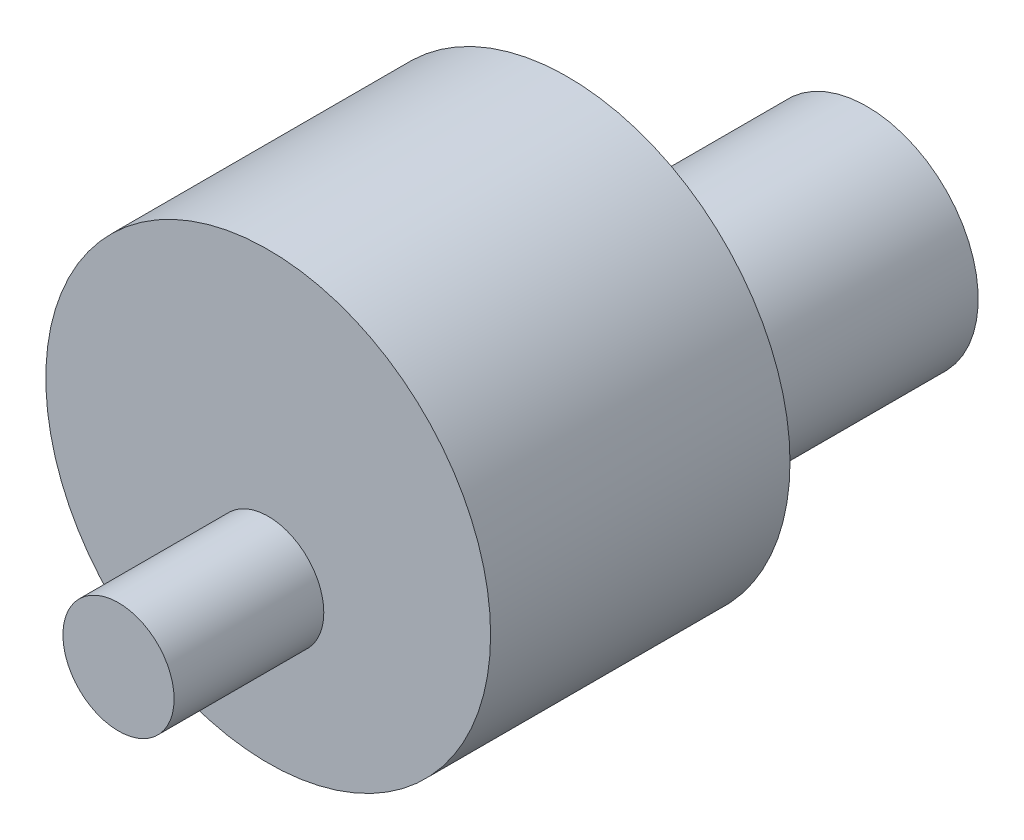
SolidWorks part; units mm, degrees
ref_plane "Front Plane" through (0, 0, 0) normal (0, 0, 1) x (1, 0, 0)
ref_plane "Top Plane" through (0, 0, 0) normal (0, 1, 0) x (1, 0, 0)
ref_plane "Right Plane" through (0, 0, 0) normal (1, 0, 0) x (0, 0, -1)
sketch "Sketch2" plane through (0, 0, 0) normal (0, 0, 1) x (1, 0, 0)
  circle A0 centre (0, 0) radius 132.08
extrude "Boss-Extrude1" add sketch "Sketch2" along normal blind 177.8
sketch "Sketch3" plane through (0, 0, 0) normal (0, 0, -1) x (-1, 0, 0)
  circle A0 centre (0, -38.1) radius 66.04
extrude "Boss-Extrude2" add sketch "Sketch3" along normal blind 177.8
sketch "Sketch4" plane through (0, 0, 177.8) normal (0, 0, 1) x (1, 0, 0)
  circle A0 centre (0, -38.1) radius 33.02
extrude "Boss-Extrude3" add sketch "Sketch4" along normal blind 88.9 contours A0
equation "\"D1@Sketch2\"=\"R\""
equation "\"D1@Sketch3\"=\"E\""
equation "\"D2@Sketch3\"=\"R\"/2"
equation "\"D1@Sketch4\"=\"R\"/4"
equation "\"D2@Sketch4\"=\"E\""
equation "\"D1@Boss-Extrude3\"=\"W\"/2"
equation "\"D1@Boss-Extrude1\"=\"W\""
equation "\"D1@Boss-Extrude2\"=\"W\""
equation "\"E\"= 1.500000"
equation "\"R\"= 10.400000"
equation "\"RRS\"= 19.536364"
equation "\"HHS\"= 11.900000"
equation "\"W\"= 7.000000"
